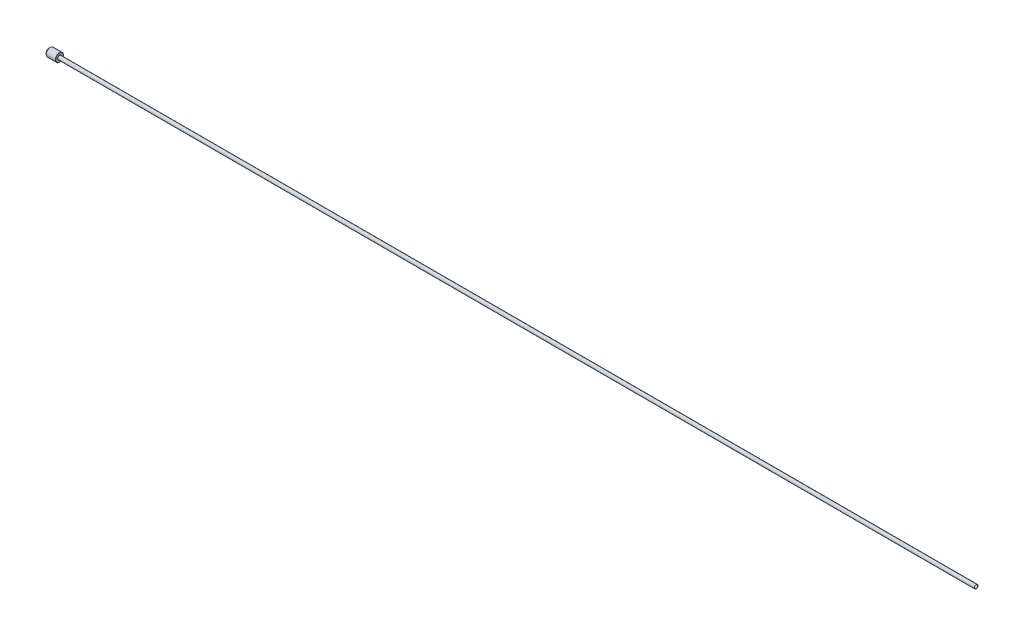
SolidWorks part; units mm, degrees
ref_plane "Front Plane" through (0, 0, 0) normal (0, 0, 1) x (1, 0, 0)
ref_plane "Top Plane" through (0, 0, 0) normal (0, 1, 0) x (1, 0, 0)
ref_plane "Right Plane" through (0, 0, 0) normal (1, 0, 0) x (0, 0, -1)
sketch "Sketch1" plane through (0, 0, 0) normal (0, 0, 1) x (1, 0, 0)
  line L0 (0.495, 2) -> (4, 2)
  line L1 (5, 0.9144) -> (450, 0.9144)
  line L2 (4, 2) -> (5, 2)
  line L4 (5, 2) -> (5, 0.9144)
  line L5 (450, 0.9144) -> (450, 0.762)
  line L7 (450, 0.762) -> (0, 0.762)
  line L8 (0, 0.762) -> (0, 1.605)
  line L9 (-22.2122, 0) -> (63.2184, 0) construction
  line L10 (0, 1.605) -> (0.1, 1.605)
  line L12 (0.1, 1.605) -> (0.495, 2)
  dimension "D2" = 1
  dimension "Thread" = 4
  dimension "D3" = 5
  dimension "tube ID" = 1.524
  dimension "D4" = 1.8288
  dimension "D5" = 450
  dimension "minor diameter" = 3.21
  dimension "D9" = 45
  dimension "D10" = 0.1
revolve "Revolve1" add sketch "Sketch1" angle 360 about L9
fillet "Fillet1" radius 0.1 1 edges at (5, 0, 2)
